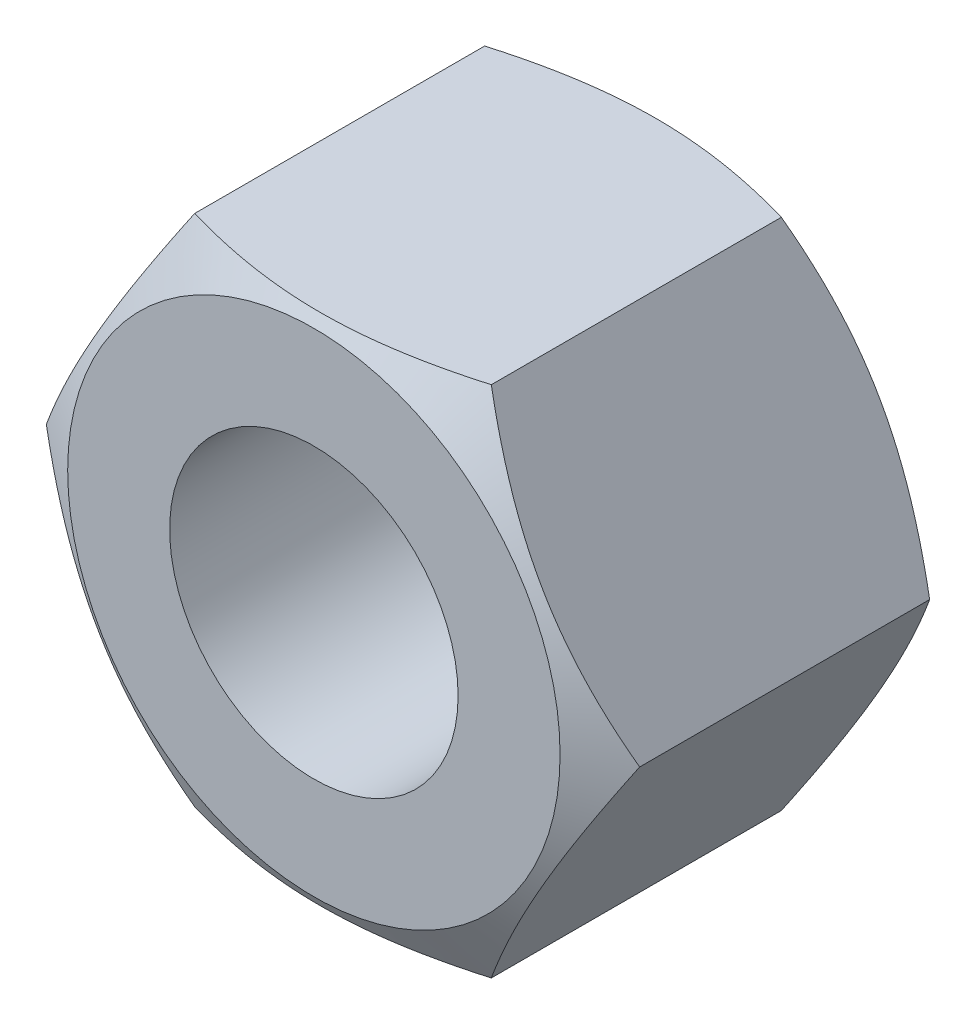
SolidWorks part; units mm, degrees
ref_plane "Front" through (0, 0, 0) normal (0, 0, 1) x (1, 0, 0)
ref_plane "Top" through (0, 0, 0) normal (0, 1, 0) x (1, 0, 0)
ref_plane "Right" through (0, 0, 0) normal (1, 0, 0) x (0, 0, -1)
sketch "Sketch1" plane through (0, 0, 0) normal (0, 0, 1) x (1, 0, 0)
  line L1 (5.1962, -9) -> (10.3923, 0)
  line L2 (10.3923, 0) -> (5.1962, 9)
  line L3 (5.1962, 9) -> (-5.1962, 9)
  line L4 (-5.1962, 9) -> (-10.3923, 0)
  line L5 (-10.3923, 0) -> (-5.1962, -9)
  line L6 (-5.1962, -9) -> (5.1962, -9)
  circle A0 centre (0, 0) radius 9 construction
  circle A1 centre (0, 0) radius 5.053
extrude "BaseNut" add sketch "Sketch1" against normal blind 12.2
sketch "Sketch2" plane through (0, 0, 0) normal (0, 1, 0) x (1, 0, 0)
  line L0 (-10.3923, 12.2) -> (-8.625, 12.2)
  line L2 (-8.625, 12.2) -> (-10.3923, 11.1796)
  line L3 (-10.3923, 11.1796) -> (-10.3923, 12.2)
  line L4 (0, 3.3759) -> (0, -9.8171) construction
  line L6 (-9.7712, 6.1) -> (9.8853, 6.1) construction
  line L7 (-10.3923, 1.0204) -> (-10.3923, 0)
  line L8 (-8.625, 0) -> (-10.3923, 1.0204)
  line L9 (-10.3923, 0) -> (-8.625, 0)
  line L10 (-10.3923, 12.2) -> (-10.3923, 0) construction
revolve "Double-Chamfer" cut sketch "Sketch2" angle 360 about L4
sketch "Sketch4" plane through (0, 0, 0) normal (0, 1, 0) x (1, 0, 0)
  line L0 (5.8731, 12.2) -> (5.053, 11.7265)
  line L1 (5.053, 11.7265) -> (4.106, 11.7265)
  line L2 (4.106, 11.7265) -> (4.106, 12.6735)
  line L3 (4.106, 12.6735) -> (5.053, 12.6735)
  line L4 (5.053, 12.6735) -> (5.8731, 12.2)
  line L5 (0, 0) -> (0, 109.7681) construction
revolve "Cut-Revolve10" [suppressed] cut sketch "Sketch4" angle 360 about L5
pattern_linear "LPattern10" [suppressed] count 12 spacing 0.8118 along (0, 0, -1)
equation "\"dw@Sketch2\" = \"s@Sketch1\"-0.75"
equation "\"D2@Sketch2\" = \"m@BaseNut\" / 2"
equation "\"D2@Sketch4\"=\"D@Sketch1\""
equation "\"D1@Sketch4\" =  (\"D@ThreadCosmetic1\" - \"D2@Sketch4\"  )  / 2"
equation "\"D3@LPattern10\" = \"D1@Sketch4\" * 1.2"
equation "\"D1@LPattern10\" = \"m@BaseNut\" / \"D3@LPattern10\" + 1"
